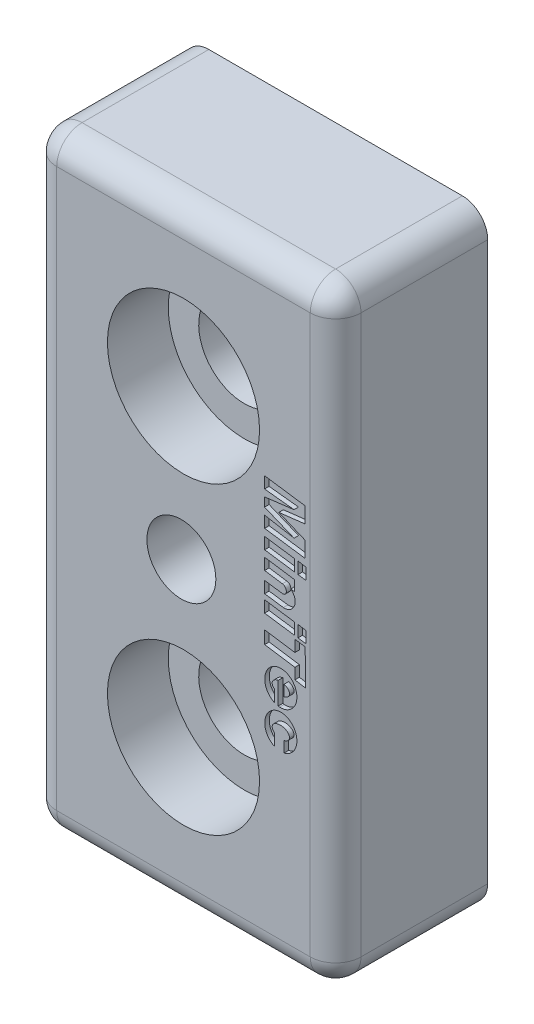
SolidWorks part; units mm, degrees
ref_plane "Front Plane" through (0, 0, 0) normal (0, 0, 1) x (1, 0, 0)
ref_plane "Top Plane" through (0, 0, 0) normal (0, 1, 0) x (1, 0, 0)
ref_plane "Right Plane" through (0, 0, 0) normal (1, 0, 0) x (0, 0, -1)
imported_body "Imported1"
hole_wizard "M8x1.25 Tapped Hole" positions "3DSketch3" profile "Sketch5" tap size "M8x1.25" standard "Ansi Metric"
sketch3d "3DSketch3"
  line L1 (-12.459, 45.5583, 12.5) -> (12.541, 45.5583, 12.5) construction
  line L2 (-14.959, -11.9417, 12.5) -> (-14.959, 43.0583, 12.5) construction
  point P2 (-0.1688, 15.6626, 15)
  dimension "D1" = 30
  dimension "D2" = 15
sketch "Sketch5" plane through (-0.1688, 15.6626, 15) normal (1, 0, 0) x (0, -1, 0)
  line L0 (0, 0) -> (0, 24.2929)
  line L1 (0, 24.2929) -> (3.4, 22.25)
  line L2 (3.4, 22.25) -> (3.4, 0)
  line L5 (3.4, 0) -> (0, 0)
  line L10 (0, 24.2929) -> (-3.4, 22.25) construction
  line L11 (0, -6.35) -> (0, 107.95) construction
  dimension "Tap Drill Dia." = 6.8
  dimension "Tap Drill Depth" = 22.25
  dimension "Drill Angle" = 118
